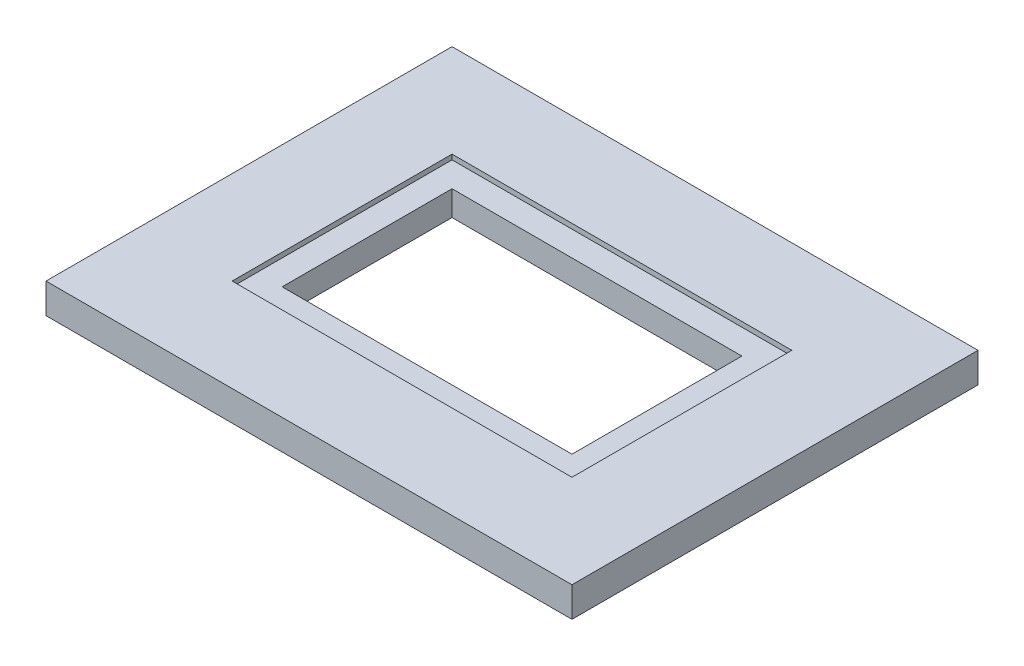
SolidWorks part; units mm, degrees
ref_plane "Front Plane" through (0, 0, 0) normal (0, 0, 1) x (1, 0, 0)
ref_plane "Top Plane" through (0, 0, 0) normal (0, 1, 0) x (1, 0, 0)
ref_plane "Right Plane" through (0, 0, 0) normal (1, 0, 0) x (0, 0, -1)
sketch "Sketch1" plane through (0, 0, 0) normal (0, 1, 0) x (1, 0, 0)
  line L1 (92.075, -53.975) -> (-92.075, -53.975)
  line L2 (92.075, -53.975) -> (92.075, 53.975)
  line L3 (92.075, 53.975) -> (-92.075, 53.975)
  line L4 (-92.075, -53.975) -> (-92.075, 53.975)
  line L5 (92.075, -53.975) -> (-92.075, 53.975) construction
  line L6 (92.075, 53.975) -> (-92.075, -53.975) construction
  line L7 (167.075, -128.975) -> (-167.075, -128.975)
  line L8 (167.075, -128.975) -> (167.075, 128.975)
  line L9 (167.075, 128.975) -> (-167.075, 128.975)
  line L10 (-167.075, -128.975) -> (-167.075, 128.975)
  line L11 (167.075, -128.975) -> (-167.075, 128.975) construction
  line L12 (167.075, 128.975) -> (-167.075, -128.975) construction
  point P0 (0, 0)
  point P6 (0, 0)
  dimension "D1" = 107.95
  dimension "D2" = 184.15
  dimension "D3" = 75
  dimension "D4" = 75
extrude "Boss-Extrude1" add sketch "Sketch1" along normal blind 19.05
sketch "Sketch2" plane through (0, 19.05, 0) normal (0, 1, 0) x (1, 0, 0)
  line L0 (-107.95, 69.85) -> (107.95, 69.85)
  line L1 (-92.075, 53.975) -> (92.075, 53.975)
  line L2 (-92.075, 53.975) -> (-92.075, -53.975)
  line L3 (-92.075, -53.975) -> (92.075, -53.975)
  line L4 (92.075, 53.975) -> (92.075, -53.975)
  line L5 (107.95, 69.85) -> (107.95, -69.85)
  line L6 (-107.95, -69.85) -> (107.95, -69.85)
  line L7 (-107.95, 69.85) -> (-107.95, -69.85)
  dimension "D1" = 15.875
extrude "Cut-Extrude1" cut sketch "Sketch2" against normal blind 3.175
